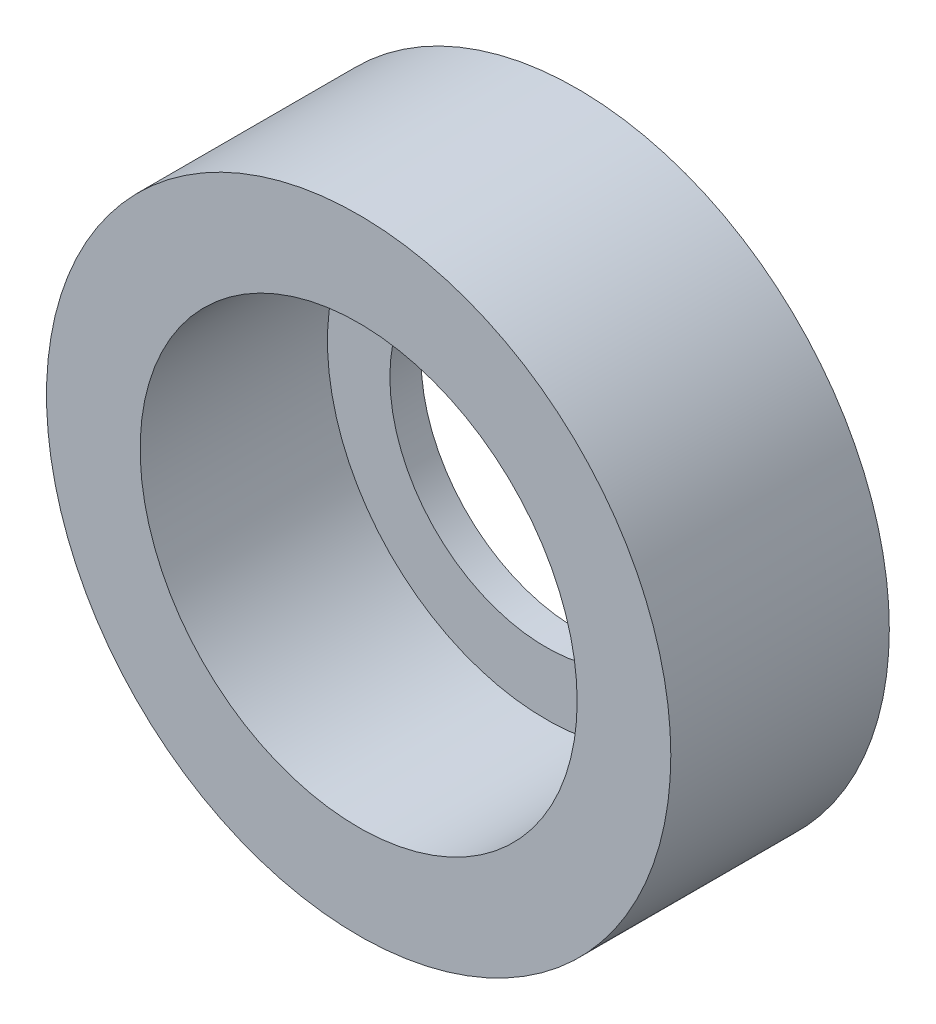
SolidWorks part; units mm, degrees
ref_plane "Face" through (0, 0, 0) normal (0, 0, 1) x (1, 0, 0)
ref_plane "Dessus" through (0, 0, 0) normal (0, 1, 0) x (1, 0, 0)
ref_plane "Droite" through (0, 0, 0) normal (1, 0, 0) x (0, 0, -1)
sketch "Esquisse1" plane through (0, 0, 0) normal (0, 0, 1) x (1, 0, 0)
  circle A0 centre (0, 0) radius 5
  dimension "D1" = 10
extrude "Extrusion1" add sketch "Esquisse1" along normal blind 3.5
hole_wizard "Trou taraudé M8x1.01" positions "Esquisse3" profile "Esquisse2" tap size "M8x1.0" standard "ISO"
sketch "Esquisse3" plane through (0, 0, 3.5) normal (0, 0, 1) x (1, 0, 0)
  circle A0 centre (0, 0) radius 5 construction
  point P0 (0, 0)
sketch "Esquisse2" plane through (0, 0, 3.5) normal (1, 0, 0) x (0, -1, 0)
  line L0 (0, 0) -> (0, 3)
  line L1 (0, 3) -> (3.5, 3)
  line L2 (3.5, 3) -> (3.5, 0)
  line L5 (3.5, 0) -> (0, 0)
  line L10 (0, 3) -> (-3.5, 3) construction
  line L11 (0, -6.35) -> (0, 107.95) construction
  dimension "Diamètre du trou pour taraudage" = 7
  dimension "Profondeur du trou pour taraudage" = 3
  dimension "Angle de pointe" = 180
sketch "Esquisse4" plane through (0, 0, 0) normal (0, 0, -1) x (-1, 0, 0)
  circle A0 centre (0, 0) radius 2.5
  dimension "D1" = 5
extrude "Enlèv. mat.-Extru.1" cut sketch "Esquisse4" against normal through all
